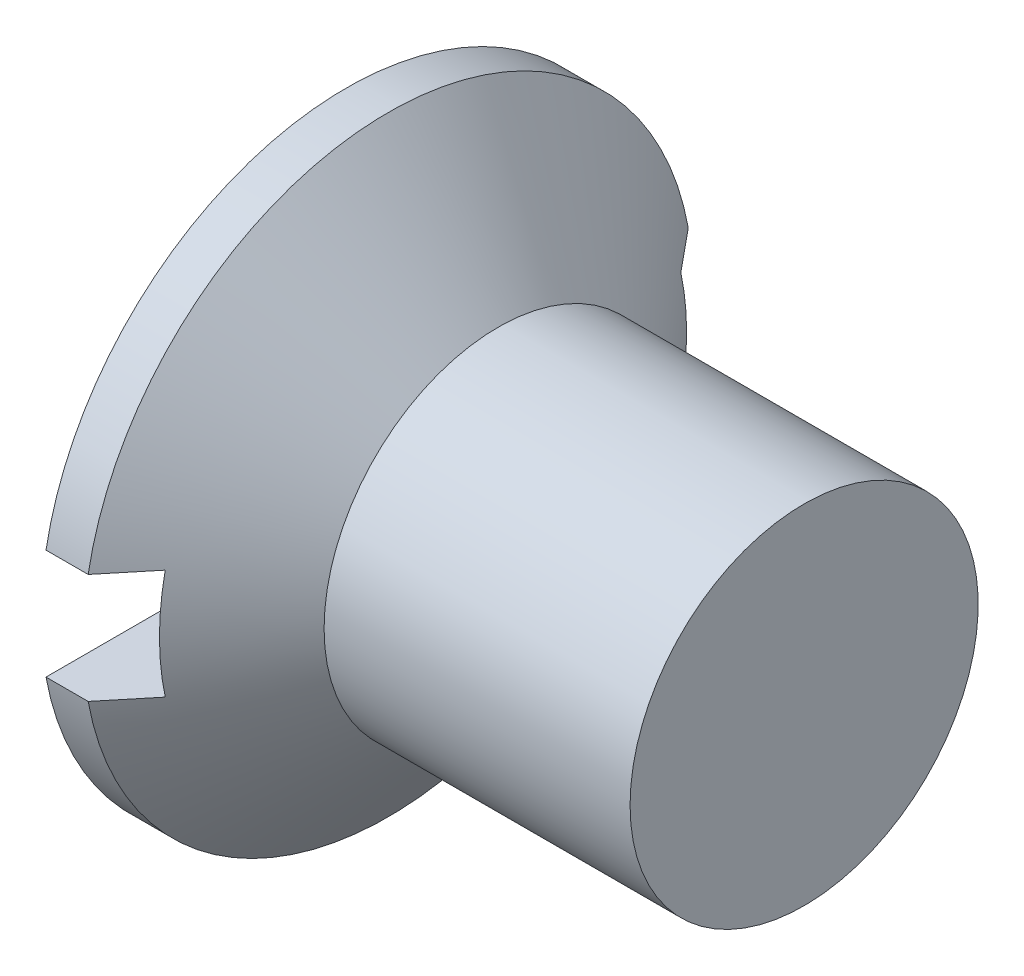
SolidWorks part; units mm, degrees
revolve "Base-Revolve" add sketch "BodySke" angle 360 about L5
sketch "BodySke" plane through (0, 0, 0) normal (0, 0, 1) x (1, 0, 0)
  line L0 (0, 0) -> (0, 4.2291)
  line L1 (0, 4.2291) -> (0.5843, 4.2291)
  line L2 (2.1082, 2.413) -> (6.35, 2.413)
  line L3 (6.35, 2.413) -> (6.35, 0)
  line L4 (6.35, 0) -> (0, 0)
  line L5 (-6.35, 0) -> (82.55, 0) construction
  line L6 (2.1082, -2.413) -> (6.35, -2.413) construction
  line L7 (0.5843, -4.2291) -> (2.1082, -2.413) construction
  line L8 (0.5843, 4.2291) -> (2.1082, 2.413)
  line L9 (0, -4.2291) -> (0.5843, -4.2291) construction
  line L10 (3.1674, 4.0005) -> (3.1674, -5.5245) construction
  line L11 (0, 6.35) -> (0, -3.175) construction
extrude "Slot" cut sketch "Sketch2" against normal blind 1.0668
sketch "Sketch2" plane through (0, 0, 0) normal (-1, 0, 0) x (0, 0, 1)
  line L0 (-4.2291, -0.762) -> (4.2291, -0.762)
  line L1 (-4.2291, -0.762) -> (-4.2291, 0.762)
  line L2 (4.2291, 0.762) -> (-4.2291, 0.762)
  line L3 (4.2291, 0.762) -> (4.2291, -0.762)
ref_plane "Plane1" through (0, 0, 0) normal (0, 0, 1) x (1, 0, 0)
ref_plane "Plane2" through (0, 0, 0) normal (0, 1, 0) x (1, 0, 0)
ref_plane "Plane3" through (0, 0, 0) normal (1, 0, 0) x (0, 0, -1)
sketch "Sketch3" plane through (0, 0, 0) normal (-1, 0, 0) x (0, 0, 1)
  line L0 (-0.5334, 2.8575) -> (0.5334, 2.8575)
  line L1 (0.5334, 2.8575) -> (0.5334, -2.8575)
  line L2 (0.5334, -2.8575) -> (-0.5334, -2.8575)
  line L3 (-0.5334, -2.8575) -> (-0.5334, 2.8575)
ref_plane "Plane4" through (3.7338, 0, 0) normal (-1, 0, 0) x (0, 0, 1)
sketch "Sketch4" plane through (3.7338, 0, 0) normal (-1, 0, 0) x (0, 0, 1)
  line L0 (-0.2667, 0.2667) -> (0.2667, 0.2667)
  line L3 (0.2667, 0.2667) -> (0.2667, -0.2667)
  line L4 (0.2667, -0.2667) -> (-0.2667, -0.2667)
  line L5 (-0.2667, -0.2667) -> (-0.2667, 0.2667)
loft "Cross" cut profiles "Sketch3", "Sketch4"
pattern_circular "CirPattern1" count 2 every 90 about axis through (0, 0, 0) along (1, 0, 0) of "Cross"
sketch "ThdSchSke" plane through (0, 0, 0) normal (0, 0, 1) x (1, 0, 0)
  line L0 (3.1674, -1.7831) -> (2.7263, -2.413)
  line L1 (3.1674, -1.7831) -> (3.6085, -2.413)
  line L2 (3.6085, -2.413) -> (3.6085, -3.0162)
  line L3 (-3.175, 0) -> (5.1513, 0) construction
  line L5 (3.6085, -3.0162) -> (2.7263, -3.0162)
  line L6 (2.7263, -3.0162) -> (2.7263, -2.413)
  line L7 (0, 4.2291) -> (0, 0.762) construction
revolve "ThreadSchematic" [suppressed] cut sketch "ThdSchSke" angle 360 about L3
pattern_linear "ThdSchPat" [suppressed]
equation "\"D1@Sketch3\" = \"Cross_dia@Sketch3\" / 2"
equation "\"D2@Sketch3\" = \"Cross_width@Sketch3\" / 2"
equation "\"D1@Sketch4\" = \"Cross_width@Sketch3\" *.5"
equation "\"D2@Sketch4\" = \"D1@Sketch4\""
equation "\"D4@Sketch4\" = \"D2@Sketch4\" / 2"
equation "\"D3@Sketch4\" = \"D1@Sketch4\" / 2"
equation "\"D1@Sketch2\" = \"Slot_width@Sketch2\" / 2"
equation "\"D2@Sketch2\" = \"Head_dia@BodySke\""
equation "\"D3@Sketch2\" = \"D2@Sketch2\" / 2"
equation "\"Thread_length@ThreadCosmetic\" = ((sgn( (\"Length@BodySke\" - \"Advance@BodySke\" - \"Head_ht@BodySke\" ) - \"Thread_nom@BodySke\" )-1)*( (\"Length@BodySke\" - \"Advance@BodySke\" - \"Head_ht@BodySke\" ) - \"Thread_"
equation "\"Thread_minor@ThdSchSke\" = \"Thread_minor@ThreadCosmetic\""
equation "\"Diameter@ThdSchSke\" = \"Diameter@BodySke\""
equation "\"Overcut@ThdSchSke\" = \"Diameter@BodySke\" * 1.25"
equation "\"Start@ThdSchSke\" = 0.000001 + \"Length@BodySke\" - \"Thread_length@ThreadCosmetic\"  '---Countersunk---"
equation "\"Num_threads@ThdSchPat\" = int( \"Thread_length@ThreadCosmetic\" / \"Advance@BodySke\" + 0.999 )  + 1"
equation "\"Advance@ThdSchPat\" = \"Thread_length@ThreadCosmetic\" /  (\"Num_threads@ThdSchPat\" - 1) 'relax it"
